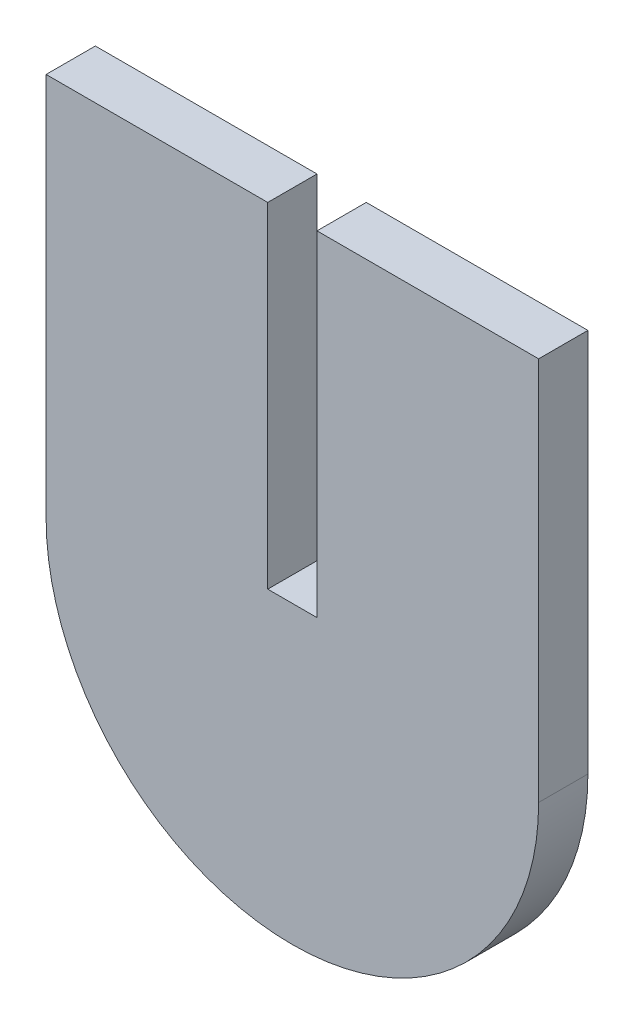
SolidWorks part; units mm, degrees
ref_plane "Front Plane" through (0, 0, 0) normal (0, 0, 1) x (1, 0, 0)
ref_plane "Top Plane" through (0, 0, 0) normal (0, 1, 0) x (1, 0, 0)
ref_plane "Right Plane" through (0, 0, 0) normal (1, 0, 0) x (0, 0, -1)
sketch "Sketch1" plane through (0, 0, 0) normal (0, 0, 1) x (1, 0, 0)
  line L1 (-15.875, 13.97) -> (15.875, 13.97)
  line L2 (-15.875, 13.97) -> (-15.875, -13.97)
  line L4 (15.875, 13.97) -> (15.875, -13.97)
  line L5 (-15.875, 13.97) -> (15.875, -13.97) construction
  line L6 (-15.875, -13.97) -> (15.875, 13.97) construction
  arc A0 (-15.875, -13.97) -> (15.875, -13.97) centre (0, -13.97) ccw
  point P0 (0, 0)
  dimension "D1" = 31.75
  dimension "D2" = 27.94
extrude "Boss-Extrude1" add sketch "Sketch1" along normal blind 3.175
sketch "Sketch2" plane through (0, 0, 3.175) normal (0, 0, 1) x (1, 0, 0)
  line L1 (-15.875, 13.97) -> (-12.7, 13.97)
  line L2 (-15.875, 13.97) -> (-15.875, 10.795)
  line L3 (-15.875, 10.795) -> (-12.7, 10.795)
  line L4 (-12.7, 13.97) -> (-12.7, 10.795)
  line L5 (15.875, 13.97) -> (12.7, 13.97)
  line L6 (15.875, 13.97) -> (15.875, 10.795)
  line L7 (15.875, 10.795) -> (12.7, 10.795)
  line L8 (12.7, 13.97) -> (12.7, 10.795)
  dimension "D1" = 3.175
  dimension "D2" = 3.175
  dimension "D3" = 3.175
  dimension "D4" = 3.175
extrude "Cut-Extrude1" cut sketch "Sketch2" against normal through all
sketch "Sketch3" plane through (0, 0, 3.175) normal (0, 0, 1) x (1, 0, 0)
  line L1 (-12.7, 13.97) -> (12.7, 13.97)
  line L2 (-12.7, 13.97) -> (-12.7, 10.795)
  line L3 (-12.7, 10.795) -> (12.7, 10.795)
  line L4 (12.7, 13.97) -> (12.7, 10.795)
extrude "Cut-Extrude2" cut sketch "Sketch3" against normal through all
sketch "Sketch4" plane through (0, 0, 3.175) normal (0, 0, 1) x (1, 0, 0)
  line L0 (-15.875, 10.795) -> (15.875, 10.795) construction
  line L1 (1.5875, 10.795) -> (-1.5875, 10.795)
  line L2 (1.5875, 10.795) -> (1.5875, -10.795)
  line L3 (1.5875, -10.795) -> (-1.5875, -10.795)
  line L4 (-1.5875, 10.795) -> (-1.5875, -10.795)
  line L5 (1.5875, 10.795) -> (-1.5875, -10.795) construction
  line L6 (1.5875, -10.795) -> (-1.5875, 10.795) construction
  point P0 (0, 0)
  dimension "D1" = 3.175
  dimension "D2" = 21.59
extrude "Cut-Extrude3" cut sketch "Sketch4" against normal through all
